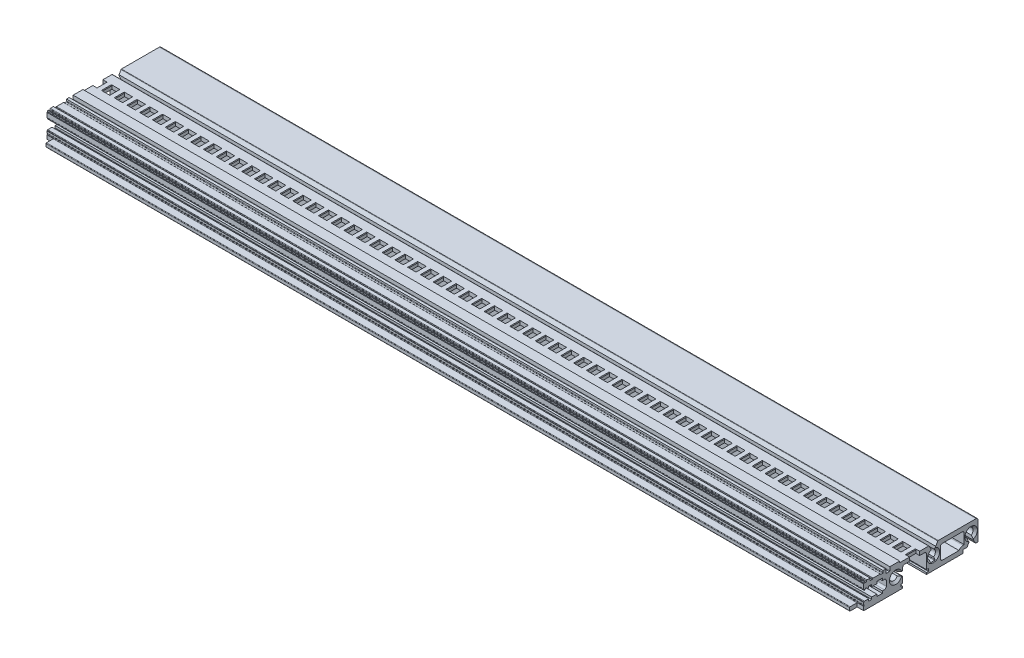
SolidWorks part; units mm, degrees
other "34566284"
ref_plane "前视基准面" through (0, 0, 0) normal (0, 0, 1) x (1, 0, 0)
ref_plane "上视基准面" through (0, 0, 0) normal (0, 1, 0) x (1, 0, 0)
ref_plane "右视基准面" through (0, 0, 0) normal (1, 0, 0) x (0, 0, -1)
imported_body "输入1"
sketch "草图1" plane through (0, 0, 0) normal (0, 1, 0) x (1, 0, 0)
  line L0 (-215.9, 9.4065) -> (-215.9, 24.45) construction
  line L1 (215.9, 38.2696) -> (109.22, 38.2696)
  line L2 (215.9, 38.2696) -> (215.9, -28.5682)
  line L3 (215.9, -28.5682) -> (109.22, -28.5682)
  line L4 (109.22, 38.2696) -> (109.22, -28.5682)
  line L5 (215.9, 9.4065) -> (215.9, 24.45) construction
  dimension "D1" = 325.12
extrude "切除-拉伸1" cut sketch "草图1" against normal mid plane 37
sketch "草图2" plane through (109.22, 0, 0) normal (1, 0, 0) x (0, 0, -1)
  circle A0 centre (-7.5, -4.2) radius 1.65
  circle A1 centre (7.5, -4.2) radius 1.65
  circle A2 centre (22.5, -4.2) radius 1.65
extrude "切除-拉伸2" cut sketch "草图2" against normal blind 15.02
chamfer "倒角1" distance 0.85 angle 45 4 edges at (109.22, -4.2, -24.15) (109.22, -4.2, -20.85) (109.22, -4.2, -5.85) (109.22, -4.2, 9.15)
sketch "草图3" plane through (0, -7.9, 0) normal (0, 1, 0) x (1, 0, 0)
  line L1 (109.22, -23.25) -> (106.62, -23.25)
  line L2 (109.22, -23.25) -> (109.22, -20.25)
  line L3 (109.22, -20.25) -> (106.62, -20.25)
  line L4 (106.62, -23.25) -> (106.62, -20.25)
  dimension "D1" = 2.6
  dimension "D2" = 3
extrude "切除-拉伸3" cut sketch "草图3" against normal mid plane 10
